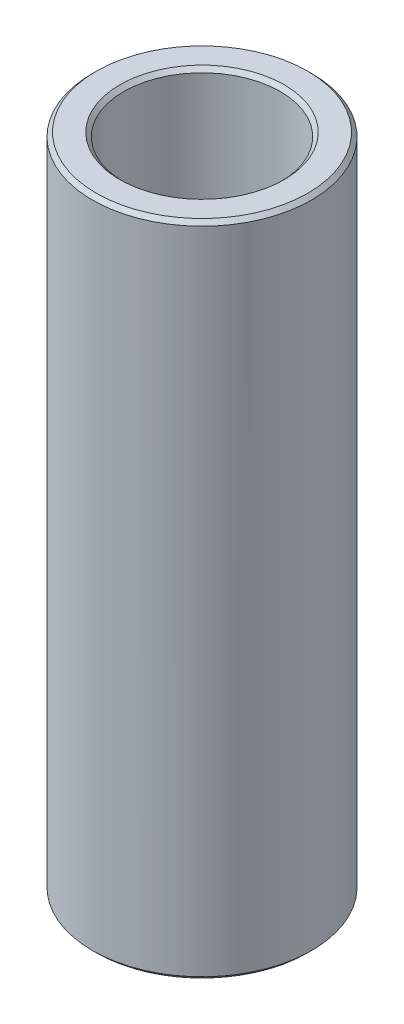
SolidWorks part; units mm, degrees
ref_plane "Front Plane" through (0, 0, 0) normal (0, 0, 1) x (1, 0, 0)
ref_plane "Top Plane" through (0, 0, 0) normal (0, 1, 0) x (1, 0, 0)
ref_plane "Right Plane" through (0, 0, 0) normal (1, 0, 0) x (0, 0, -1)
sketch "Sketch1" plane through (0, 0, 0) normal (0, 0, 1) x (1, 0, 0)
  line L0 (0, 0) -> (0, 42) construction
  line L1 (-7, 42) -> (-5, 42)
  line L2 (-5, 42) -> (-5, 0)
  line L3 (-5, 0) -> (-7, 0)
  line L4 (-7, 0) -> (-7, 42)
  dimension "D1" = 2
  dimension "D2" = 10
  dimension "D3" = 42
revolve "Revolve1" add sketch "Sketch1" angle 360 about L0
chamfer "Chamfer1" distance 0.25 angle 45 4 edges at (0, 0, -5) (0, 0, -7) (0, 42, -7) (0, 42, -5)
